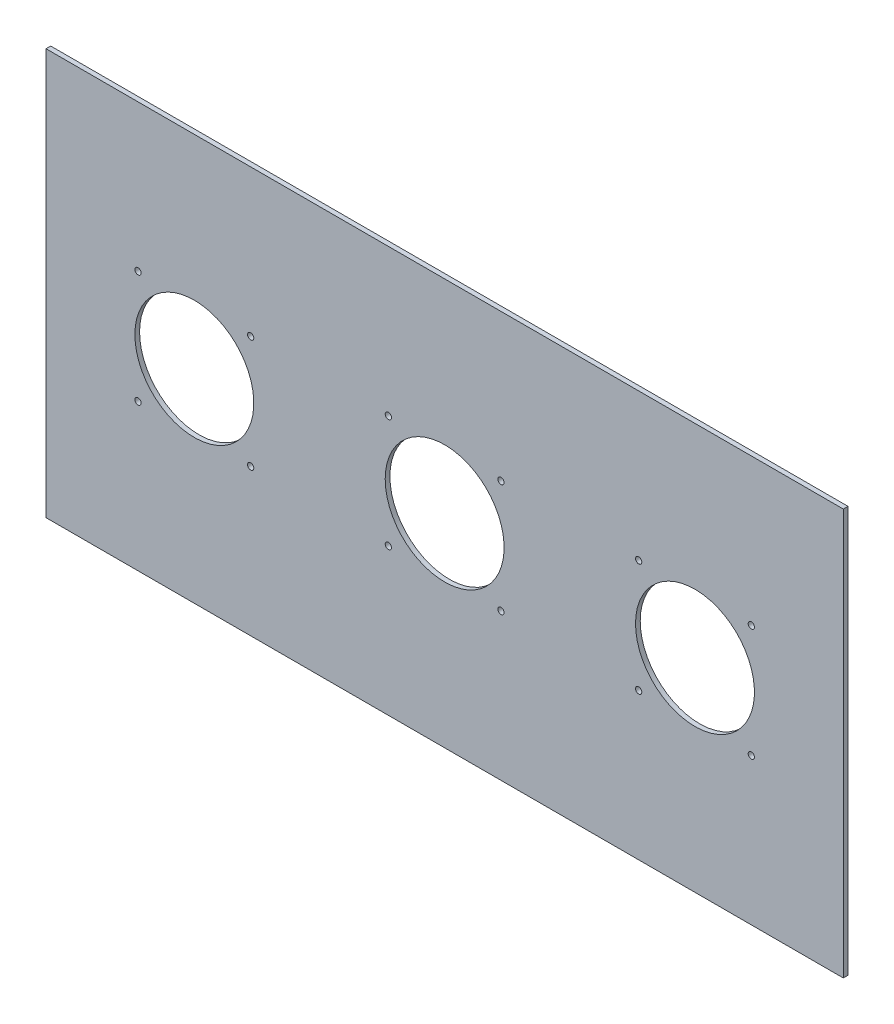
SolidWorks part; units mm, degrees
ref_plane "Plan de face" through (0, 0, 0) normal (0, 0, 1) x (1, 0, 0)
ref_plane "Plan de dessus" through (0, 0, 0) normal (0, 1, 0) x (1, 0, 0)
ref_plane "Plan de droite" through (0, 0, 0) normal (1, 0, 0) x (0, 0, -1)
sketch "Esquisse1" plane through (0, 0, 0) normal (0, 0, 1) x (1, 0, 0)
  line L1 (-254.8, -129.8) -> (254.8, -129.8)
  line L2 (-254.8, -129.8) -> (-254.8, 129.8)
  line L3 (-254.8, 129.8) -> (254.8, 129.8)
  line L4 (254.8, -129.8) -> (254.8, 129.8)
  line L5 (-254.8, -129.8) -> (254.8, 129.8) construction
  line L6 (-254.8, 129.8) -> (254.8, -129.8) construction
  point P0 (0, 0)
extrude "Boss.-Extru.1" add sketch "Esquisse1" along normal blind 3 contours L2 L3 L4 L1
sketch "Esquisse2" plane through (0, 0, 0) normal (0, 0, 1) x (1, 0, 0)
  line L1 (-36, -36) -> (36, -36) construction
  line L2 (-36, -36) -> (-36, 36) construction
  line L3 (-36, 36) -> (36, 36) construction
  line L4 (36, -36) -> (36, 36) construction
  line L5 (-36, -36) -> (36, 36) construction
  line L6 (-36, 36) -> (36, -36) construction
  circle A0 centre (-36, 36) radius 2
  circle A1 centre (36, 36) radius 2
  circle A2 centre (-36, -36) radius 2
  circle A3 centre (36, -36) radius 2
  circle A4 centre (0, 0) radius 38
  point P0 (0, 0)
extrude "Enlèv. mat.-Extru.1" cut sketch "Esquisse2" along normal up to next
other "Répétition dans une zone1" parameters "D5"=0, "D6"=0, "D4"=160, "D9"=3, "D3"=0, "D7"=2, "D8"=6
